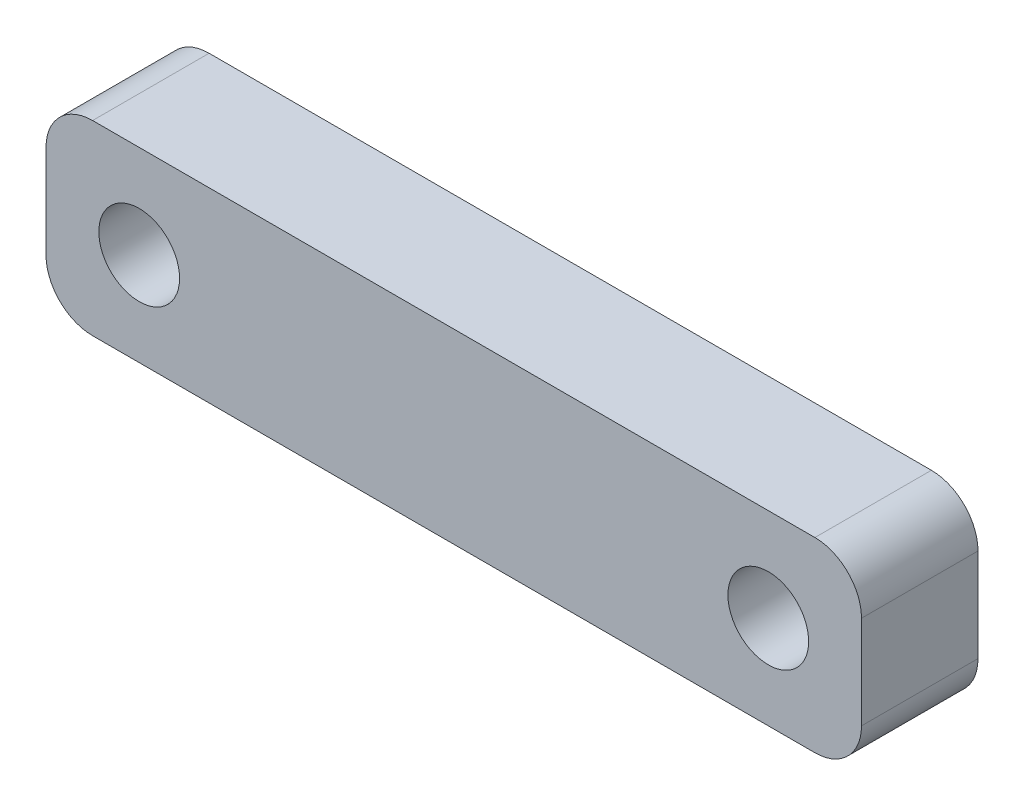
SolidWorks part; units mm, degrees
ref_plane "Front Plane" through (0, 0, 0) normal (0, 0, 1) x (1, 0, 0)
ref_plane "Top Plane" through (0, 0, 0) normal (0, 1, 0) x (1, 0, 0)
ref_plane "Right Plane" through (0, 0, 0) normal (1, 0, 0) x (0, 0, -1)
sketch "Sketch1" plane through (0, 0, 0) normal (0, 0, 1) x (1, 0, 0)
  line L0 (-178.2275, -22.7363) -> (-133.7775, -22.7363) construction
  line L1 (-178.2275, -27.8163) -> (-133.7775, -27.8163)
  line L2 (-178.2275, -27.8163) -> (-178.2275, -17.6563)
  line L3 (-178.2275, -17.6563) -> (-133.7775, -17.6563)
  line L4 (-133.7775, -27.8163) -> (-133.7775, -17.6563)
  line L5 (-156.0025, -22.7363) -> (-156.0025, -27.8163) construction
  circle A0 centre (-173.1475, -22.7363) radius 2.2
  circle A1 centre (-138.8575, -22.7363) radius 2.2
  dimension "D3" = 4.4
  dimension "D1" = 44.45
  dimension "D2" = 10.16
  dimension "D4" = 5.08
extrude "Boss-Extrude1" add sketch "Sketch1" along normal blind 6.35
fillet "Fillet1" radius 2.54 4 edges at (-133.7775, -17.6563, 3.175) (-133.7775, -27.8163, 3.175) (-178.2275, -17.6563, 3.175) (-178.2275, -27.8163, 3.175)
